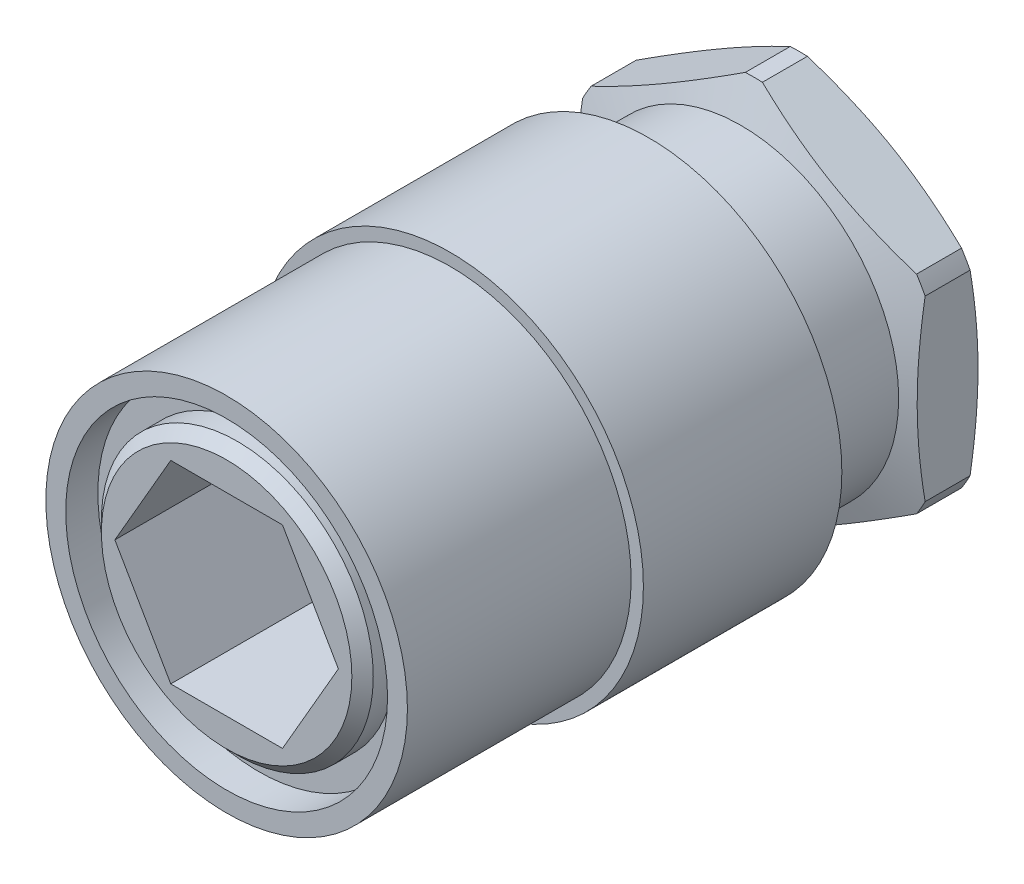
SolidWorks part; units mm, degrees
ref_plane "Front Plane" through (0, 0, 0) normal (0, 0, 1) x (1, 0, 0)
ref_plane "Top Plane" through (0, 0, 0) normal (0, 1, 0) x (1, 0, 0)
ref_plane "Right Plane" through (0, 0, 0) normal (1, 0, 0) x (0, 0, -1)
sketch "Sketch2" plane through (0, 0, 0) normal (0, 0, 1) x (1, 0, 0)
  circle A0 centre (0, 0) radius 9.017
  dimension "D1" = 18.034
extrude "Boss-Extrude1" add sketch "Sketch2" against normal blind 27.3304
sketch "Sketch5" plane through (0, 0, -27.3304) normal (0, 0, -1) x (-1, 0, 0)
  line L1 (-8.001, -4.6194) -> (0, -9.2388)
  line L2 (0, -9.2388) -> (8.001, -4.6194)
  line L3 (8.001, -4.6194) -> (8.001, 4.6194)
  line L4 (8.001, 4.6194) -> (0, 9.2388)
  line L5 (0, 9.2388) -> (-8.001, 4.6194)
  line L6 (-8.001, 4.6194) -> (-8.001, -4.6194)
  circle A0 centre (0, 0) radius 8.001 construction
  dimension "D1" = 16.002
extrude "Cut-Extrude1" cut sketch "Sketch5" against normal blind 3.302 flip side to cut
sketch "Sketch6" plane through (0, 0, 0) normal (1, 0, 0) x (0, 0, -1)
  line L0 (24.0284, 9.0081) -> (24.0284, 4.85) construction
  line L1 (24.0284, 7.366) -> (19.7231, 7.366)
  line L2 (24.0284, 7.366) -> (24.0284, 9.906)
  line L3 (24.0284, 9.906) -> (19.7231, 9.906)
  line L4 (19.7231, 7.366) -> (19.7231, 9.906)
  line L5 (0, 0) -> (27.3304, 0) construction
  line L6 (27.3304, -4.1582) -> (27.3304, 4.1582) construction
  dimension "D1" = 14.732
  dimension "D2" = 4.3053
  dimension "D3" = 2.54
revolve "Cut-Revolve1" cut sketch "Sketch6" angle 360 about L5
sketch "Sketch11" plane through (0, 0, 0) normal (0, 0, 1) x (1, 0, 0)
  circle A1 centre (0, 0) radius 6.35
  circle A2 centre (0, 0) radius 7.517
  circle A3 centre (0, 0) radius 7.517
  dimension "D2" = 12.7
  dimension "D1" = 1.5
extrude "Cut-Extrude3" cut sketch "Sketch11" against normal blind 1.5
sketch "Sketch12" plane through (0, 0, 0) normal (1, 0, 0) x (0, 0, -1)
  line L0 (24.0284, 9.5161) -> (24.0284, 7.366)
  line L1 (24.0284, 7.366) -> (24.811, 9.5161)
  line L2 (26.5478, 9.5161) -> (27.3304, 9.5161)
  line L3 (24.0284, 9.0081) -> (24.0284, 4.85) construction
  line L4 (0, 0) -> (27.3304, 0) construction
  line L5 (27.3304, -4.1582) -> (27.3304, 4.1582) construction
  line L7 (24.0284, 9.0081) -> (27.3304, 9.0081) construction
  line L11 (27.3304, 7.366) -> (27.3304, 9.5161)
  line L12 (27.3304, -8.001) -> (27.3304, 8.001) construction
  line L13 (24.0284, 9.5161) -> (24.811, 9.5161)
  line L17 (26.5478, 9.5161) -> (27.3304, 7.366)
  dimension "D1" = 7.366
  dimension "D2" = 20
  dimension "D3" = 20
  dimension "D4" = 0.508
revolve "Cut-Revolve2" cut sketch "Sketch12" angle 360 about L4
sketch "Sketch23" plane through (0, 0, -27.3304) normal (0, 0, -1) x (-1, 0, 0)
  circle A0 centre (0, 0) radius 5.1435
  dimension "D1" = 10.287
extrude "Cut-Extrude7" cut sketch "Sketch23" against normal blind 10 draft 3
sketch "Sketch27" plane through (0, 0, 0) normal (1, 0, 0) x (0, 0, -1)
  line L0 (19.7231, -9.017) -> (19.7231, 9.017) construction
  line L1 (0, 9.017) -> (10.4521, 9.017)
  line L2 (0, 9.017) -> (0, 8.4455)
  line L3 (0, 8.4455) -> (10.4521, 8.4455)
  line L4 (10.4521, 9.017) -> (10.4521, 8.4455)
  line L5 (0, 0) -> (19.7231, 0) construction
  line L6 (19.7231, -7.366) -> (19.7231, 7.366) construction
  dimension "D1" = 9.271
  dimension "D2" = 16.891
revolve "Cut-Revolve5" cut sketch "Sketch27" angle 360 about L5
chamfer "Chamfer5" distance 1 angle 45 1 edges at (-5.1435, 0, -27.3304)
chamfer "Chamfer7" distance 0.5 angle 45 1 edges at (6.35, 0, 0)
sketch "Sketch29" plane through (0, 0, 0) normal (1, 0, 0) x (0, 0, -1)
  line L0 (0, 0) -> (29.1635, 0)
  line L2 (29.1635, 0) -> (27.3304, 3.175)
  line L3 (10.4521, 4.445) -> (0, 4.445)
  line L4 (0, 8.4455) -> (0, -8.4455) construction
  line L5 (0, 4.445) -> (0, 0)
  line L6 (-3.9478, 0) -> (80.7658, 0) construction
  line L7 (10.4521, 4.445) -> (10.4521, 3.175)
  line L8 (10.4521, 3.175) -> (27.3304, 3.175)
  line L9 (10.4521, 9.017) -> (10.4521, -9.017) construction
  line L10 (27.3304, -7.366) -> (27.3304, 7.366) construction
  line L11 (27.3304, -49) -> (27.3304, 3.175) construction
  dimension "D1" = 8.89
  dimension "D2" = 60
  dimension "D3" = 6.35
revolve "Cut-Revolve6" cut sketch "Sketch29" angle 360 about L6
sketch "Sketch30" plane through (0, 0, 0) normal (0, 0, 1) x (1, 0, 0)
  line L1 (-2.6103, 4.5212) -> (-5.2206, 0)
  line L2 (-5.2206, 0) -> (-2.6103, -4.5212)
  line L3 (-2.6103, -4.5212) -> (2.6103, -4.5212)
  line L4 (2.6103, -4.5212) -> (5.2206, 0)
  line L5 (5.2206, 0) -> (2.6103, 4.5212)
  line L6 (2.6103, 4.5212) -> (-2.6103, 4.5212)
  circle A0 centre (0, 0) radius 4.5212 construction
  dimension "D1" = 9.0424
extrude "Cut-Extrude8" cut sketch "Sketch30" against normal up to surface (10.4521 mm away) contours L1 L2 L3 L4 L5 L6
